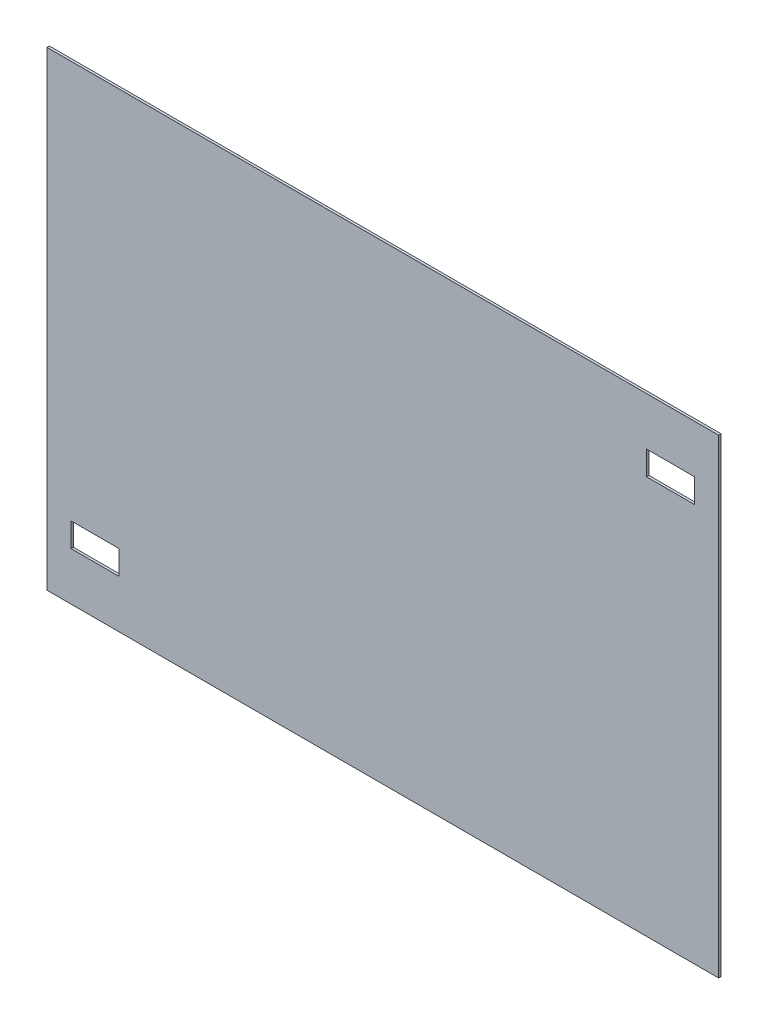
SolidWorks part; units mm, degrees
ref_plane "Front Plane" through (0, 0, 0) normal (0, 0, 1) x (1, 0, 0)
ref_plane "Top Plane" through (0, 0, 0) normal (0, 1, 0) x (1, 0, 0)
ref_plane "Right Plane" through (0, 0, 0) normal (1, 0, 0) x (0, 0, -1)
sketch "Sketch1" plane through (0, 0, 0) normal (0, 0, 1) x (1, 0, 0)
  line L2 (0, 0) -> (2794, 0)
  line L3 (0, 0) -> (0, 1955.8)
  line L4 (0, 1955.8) -> (2794, 1955.8)
  line L5 (2794, 0) -> (2794, 1955.8)
  dimension "D1" = 2794
  dimension "D2" = 1955.8
extrude "Boss-Extrude1" add sketch "Sketch1" along normal blind 10
sketch "Sketch2" plane through (0, 0, 10) normal (0, 0, 1) x (1, 0, 0)
  line L0 (0, 1955.8) -> (0, 0) construction
  line L1 (100, 300) -> (300, 300)
  line L2 (100, 300) -> (100, 200)
  line L3 (100, 200) -> (300, 200)
  line L4 (300, 300) -> (300, 200)
  line L5 (0, 0) -> (2794, 0) construction
  line L6 (2494, 1755.8) -> (2694, 1755.8)
  line L7 (2494, 1755.8) -> (2494, 1655.8)
  line L8 (2494, 1655.8) -> (2694, 1655.8)
  line L9 (2694, 1755.8) -> (2694, 1655.8)
  line L10 (2794, 1955.8) -> (0, 1955.8) construction
  line L11 (2794, 0) -> (2794, 1955.8) construction
  dimension "D1" = 200
  dimension "D2" = 100
  dimension "D3" = 100
  dimension "D4" = 200
  dimension "D5" = 100
  dimension "D6" = 200
  dimension "D7" = 200
  dimension "D8" = 100
extrude "Cut-Extrude1" cut sketch "Sketch2" against normal through all
